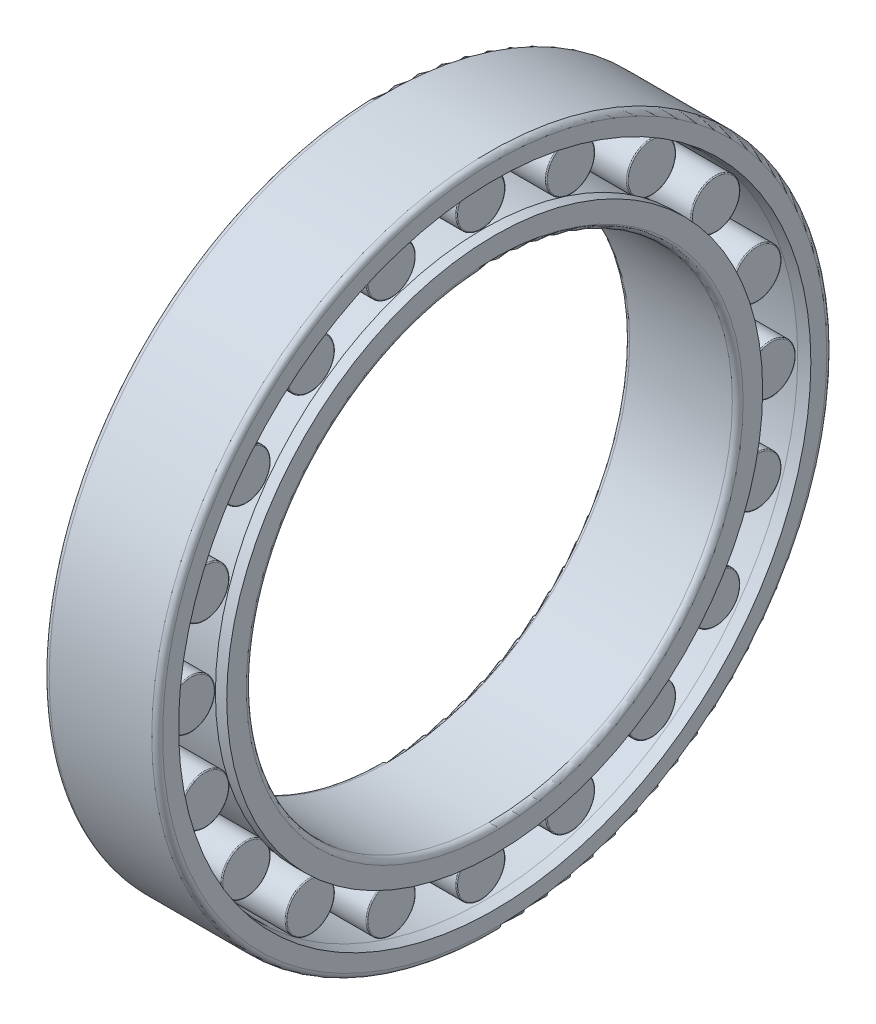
SolidWorks part; units mm, degrees
ref_plane "Plane1" through (0, 0, 0) normal (0, 0, 1) x (1, 0, 0)
ref_plane "Plane2" through (0, 0, 0) normal (0, 1, 0) x (1, 0, 0)
ref_plane "Plane3" through (0, 0, 0) normal (1, 0, 0) x (0, 0, -1)
sketch "Clipboard" plane through (0, 0, 0) normal (0, 0, 1) x (1, 0, 0)
  line L0 (-10, 0) -> (10, 0) construction
  line L1 (0, 0) -> (185.2698, -67.4327)
  line L2 (0, 0) -> (101.017, 36.7672)
  line L3 (0, 0) -> (218.798, -79.636)
  line L4 (0, 0) -> (-22.3471, -0.7804)
  dimension "CLdia" = 107.5
  dimension "Count" = 20
  dimension "Show_count" = 20
  dimension "Max_count" = 20
  dimension "Min_count" = 2
  dimension "Race_OD" = 232.84
  dimension "Race_ID" = 197.16
sketch "OutRacSke" plane through (0, 0, 0) normal (0, 0, 1) x (1, 0, 0)
  line L0 (16.8, 116.42) -> (21, 117.0867)
  line L1 (-21, 117.0867) -> (-21, 123)
  line L2 (-19, 125) -> (19, 125)
  line L3 (21, 123) -> (21, 117.0867)
  line L4 (-16.8, 116.42) -> (-21, 117.0867)
  line L6 (16.8, 116.42) -> (-16.8, 116.42)
  line L8 (-90, 0) -> (90, 0) construction
  arc A0 (-21, 123) -> (-19, 125) centre (-19, 123) cw
  arc A1 (19, 125) -> (21, 123) centre (19, 123) cw
  dimension "radius" = 2
  dimension "Race_OD" = 232.84
  dimension "OD" = 250
  dimension "Cyl_Len" = 33.6
  dimension "halfCylLen" = 16.8
  dimension "Width" = 42
  dimension "halfWidth" = 21
  dimension "groove_dp" = 0.6667
revolve "OuterRace" add sketch "OutRacSke" angle 360 about L8
sketch "RolDetSke" plane through (0, 0, 0) normal (0, 0, 1) x (1, 0, 0)
  line L0 (-15.96, 116.1851) -> (-15.96, 107.5)
  line L1 (-15.96, 107.5) -> (15.96, 107.5)
  line L2 (15.96, 107.5) -> (15.96, 116.1851)
  line L3 (15.5981, 116.547) -> (-15.5981, 116.547)
  line L4 (-33.6, 107.5) -> (33.6, 107.5) construction
  arc A0 (15.96, 116.1851) -> (15.5981, 116.547) centre (15.5981, 116.1851) ccw
  arc A1 (-15.5981, 116.547) -> (-15.96, 116.1851) centre (-15.5981, 116.1851) ccw
  dimension "radius" = 0.3619
  dimension "RolCLRad" = 107.5
  dimension "Length" = 31.92
  dimension "halfLength" = 15.96
  dimension "Roller_diameter" = 18.094
revolve "RollerDetailed" add sketch "RolDetSke" angle 360 about L4
ref_axis "Axis1" through (-50, 0, 0) along (1, 0, 0)
sketch "RolSimSke" plane through (0, 101.6, 0) normal (0, 0, 1) x (1, 0, 0)
  line L0 (-15.96, 14.5851) -> (-15.96, -2.7851)
  line L1 (25.4, -101.6) -> (-25.4, -101.6) construction
  line L2 (15.96, -2.7851) -> (15.96, 14.5851)
  line L3 (15.5981, 14.947) -> (-15.5981, 14.947)
  line L5 (15.5981, -3.147) -> (-15.5981, -3.147)
  arc A0 (15.96, 14.5851) -> (15.5981, 14.947) centre (15.5981, 14.5851) ccw
  arc A1 (-15.5981, 14.947) -> (-15.96, 14.5851) centre (-15.5981, 14.5851) ccw
  arc A2 (15.96, -2.7851) -> (15.5981, -3.147) centre (15.5981, -2.7851) cw
  arc A3 (-15.5981, -3.147) -> (-15.96, -2.7851) centre (-15.5981, -2.7851) cw
  dimension "radius" = 0.3619
  dimension "D1" = 98.453
  dimension "Roller_diameter" = 18.094
  dimension "Rol_Length" = 31.92
  dimension "halfLength" = 15.96
revolve "RollersSimplified" [suppressed] add sketch "RolSimSke" angle 360 about L1
sketch "InsRacSke" plane through (0, 0, 0) normal (0, 0, 1) x (1, 0, 0)
  line L0 (16.8, 98.58) -> (16.8, 99.2467)
  line L1 (-21, 99.2467) -> (-21, 92)
  line L2 (-19, 90) -> (19, 90)
  line L3 (21, 92) -> (21, 99.2467)
  line L4 (16.8, 99.2467) -> (21, 99.2467)
  line L5 (16.8, 98.58) -> (-16.8, 98.58)
  line L6 (-90, 0) -> (90, 0) construction
  line L8 (-16.8, 98.58) -> (-16.8, 99.2467)
  line L9 (-16.8, 99.2467) -> (-21, 99.2467)
  arc A0 (-21, 92) -> (-19, 90) centre (-19, 92) ccw
  arc A1 (19, 90) -> (21, 92) centre (19, 92) ccw
  dimension "radius" = 2
  dimension "Bore" = 180
  dimension "Race_ID" = 197.16
  dimension "Width" = 42
  dimension "halfWidth" = 21
  dimension "groove_dp" = 0.6667
  dimension "Cyl_Len" = 33.6
  dimension "halfCylLen" = 16.8
revolve "InnerRace" add sketch "InsRacSke" angle 360 about L6
pattern_circular "RollersDetailed" count 20 every 18 about axis through (-50, 0, 0) along (1, 0, 0) of "RollerDetailed"
sketch "CagSpiSke" plane through (0, 0, 0) normal (0, 0, 1) x (1, 0, 0)
  line L0 (18.9, 105.2383) -> (18.9, 109.7618)
  line L1 (18.9, 109.7618) -> (-18.9, 109.7618)
  line L2 (-18.9, 109.7618) -> (-18.9, 105.2383)
  line L3 (-18.9, 105.2383) -> (18.9, 105.2383)
  line L4 (-90, 0) -> (90, 0) construction
  dimension "Cag_IR" = 210.4765
  dimension "thickness" = 4.5235
  dimension "width" = 37.8
  dimension "halfwidth" = 18.9
revolve "CageSpine" [suppressed] add sketch "CagSpiSke" angle 360 about L4
equation "\"CLdia@Clipboard\" =  ( \"Race_OD@Clipboard\" + \"Race_ID@Clipboard\" )  / 4"
equation "\"Race_OD@OutRacSke\" = \"Race_OD@Clipboard\""
equation "\"halfCylLen@OutRacSke\" = \"Cyl_Len@OutRacSke\" / 2"
equation "\"groove_dp@OutRacSke\" = \"radius@OutRacSke\" / 3"
equation "\"RolCLRad@RolDetSke\" = \"CLdia@Clipboard\""
equation "\"Roller_diameter@RolDetSke\" =  ( \"Race_OD@Clipboard\" - \"Race_ID@Clipboard\" )  / 2 + .01"
equation "\"Roller_diameter@RolSimSke\" =  ( \"Race_OD@Clipboard\" - \"Race_ID@Clipboard\" )  / 2 + .01"
equation "\"radius@RolDetSke\" = \"Roller_diameter@RolDetSke\" / 50"
equation "\"Length@RolDetSke\" = \"Cyl_Len@OutRacSke\" * .95"
equation "\"halfLength@RolDetSke\" = \"Length@RolDetSke\" / 2"
equation "\"thickness@CagSpiSke\"  = \"Roller_diameter@RolDetSke\" * .25"
equation "\"Cag_IR@CagSpiSke\" =  \"RolCLRad@RolDetSke\" * 2 - \"thickness@CagSpiSke\""
equation "\"Rol_length@RolSimSke\" = \"Cyl_Len@InsRacSke\" * .95"
equation "\"halfLength@RolSimSke\" = \"Rol_length@RolSimSke\" / 2"
equation "\"radius@RolSimSke\" = \"radius@RolDetSke\""
equation "\"D1@RolSimSke\" = \"CLdia@Clipboard\" -  ( \"Roller_diameter@RolSimSke\" / 2 ) "
equation "\"Max_count@Clipboard\" = int( 3.14159265 / atn(( \"Roller_diameter@RolDetSke\" / 2) / sqr( \"RolCLRad@RolDetSke\"  *  \"RolCLRad@RolDetSke\" - ( \"Roller_diameter@RolDetSke\" / 2) *  ( \"Roller_diameter@RolDetS"
equation "\"Max_count@Clipboard\" = ((sgn( \"Max_count@Clipboard\" - \"Count@Clipboard\" )-1)*( \"Max_count@Clipboard\" - \"Count@Clipboard\" ))/-2+ \"Count@Clipboard\""
equation "\"Count@RollersDetailed\" = int( \"Show_count@Clipboard\" ) "
equation "\"Count@RollersDetailed\" = ((sgn( \"Count@RollersDetailed\" - \"Max_count@Clipboard\" )-1)*( \"Count@RollersDetailed\" - \"Max_count@Clipboard\" ))/-2+ \"Max_count@Clipboard\""
equation "\"Count@RollersDetailed\" = ((sgn( \"Count@RollersDetailed\" - \"Min_count@Clipboard\" )+1)*( \"Count@RollersDetailed\" - \"Min_count@Clipboard\"))/2 +\"Min_count@Clipboard\""
equation "\"Angle@RollersDetailed\" = 360.0 / \"Max_count@Clipboard\""
equation "\"radius@InsRacSke\" = \"radius@OutRacSke\""
equation "\"Width@InsRacSke\" = \"Width@OutRacSke\""
equation "\"halfWidth@OutRacSke\" = \"Width@OutRacSke\" / 2"
equation "\"halfWidth@InsRacSke\" = \"Width@InsRacSke\" / 2"
equation "\"Race_ID@InsRacSke\" = \"Race_ID@Clipboard\""
equation "\"Cyl_Len@InsRacSke\" = \"Cyl_Len@OutRacSke\""
equation "\"halfCylLen@InsRacSke\" = \"Cyl_Len@InsRacSke\" / 2"
equation "\"Angle@CageSpine\" =  \"Angle@RollersDetailed\" * ( \"Count@RollersDetailed\" -1 + int( \"Count@RollersDetailed\" / \"Max_count@Clipboard\" ) )  + 0.001 -  int( \"Count@RollersDetailed\" / \"Max_count@Clipboard\" "
equation "\"Angle@CageSpine\" =  \"Angle@CageSpine\" * int( \"Min_count@Clipboard\" / 2) + int(1 / \"Min_count@Clipboard\")  * 0.001"
equation "\"width@CagSpiSke\" =   ( \"Width@InsRacSke\" + \"Cyl_Len@InsRacSke\" )  / 2"
equation "\"halfwidth@CagSpiSke\" = \"width@CagSpiSke\" / 2"
